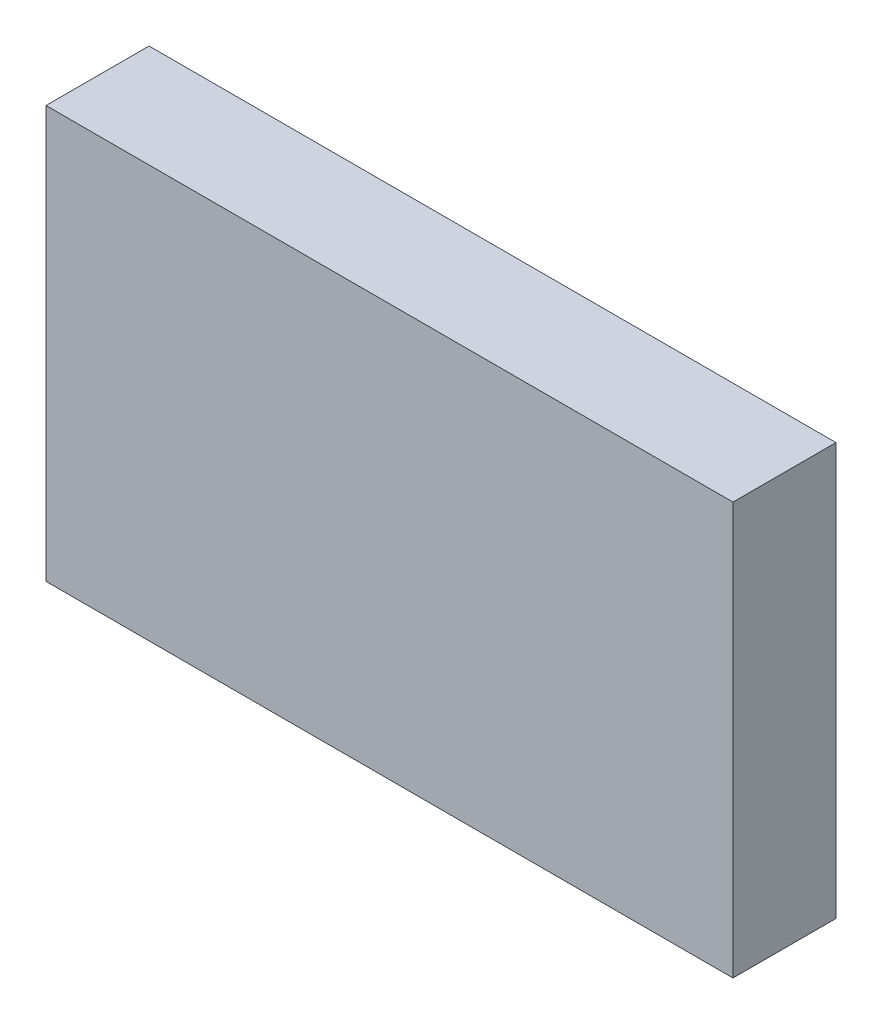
SolidWorks part; units mm, degrees
ref_plane "Face" through (0, 0, 0) normal (0, 0, 1) x (1, 0, 0)
ref_plane "Dessus" through (0, 0, 0) normal (0, 1, 0) x (1, 0, 0)
ref_plane "Droite" through (0, 0, 0) normal (1, 0, 0) x (0, 0, -1)
sketch "Esquisse1" plane through (0, 0, 0) normal (0, 0, 1) x (1, 0, 0)
  line L1 (0, 0) -> (100, 0)
  line L2 (0, 0) -> (0, -60)
  line L3 (0, -60) -> (100, -60)
  line L4 (100, 0) -> (100, -60)
  dimension "D1" = 100
  dimension "D2" = 60
extrude "Base-Extrusion" add sketch "Esquisse1" along normal blind 15
